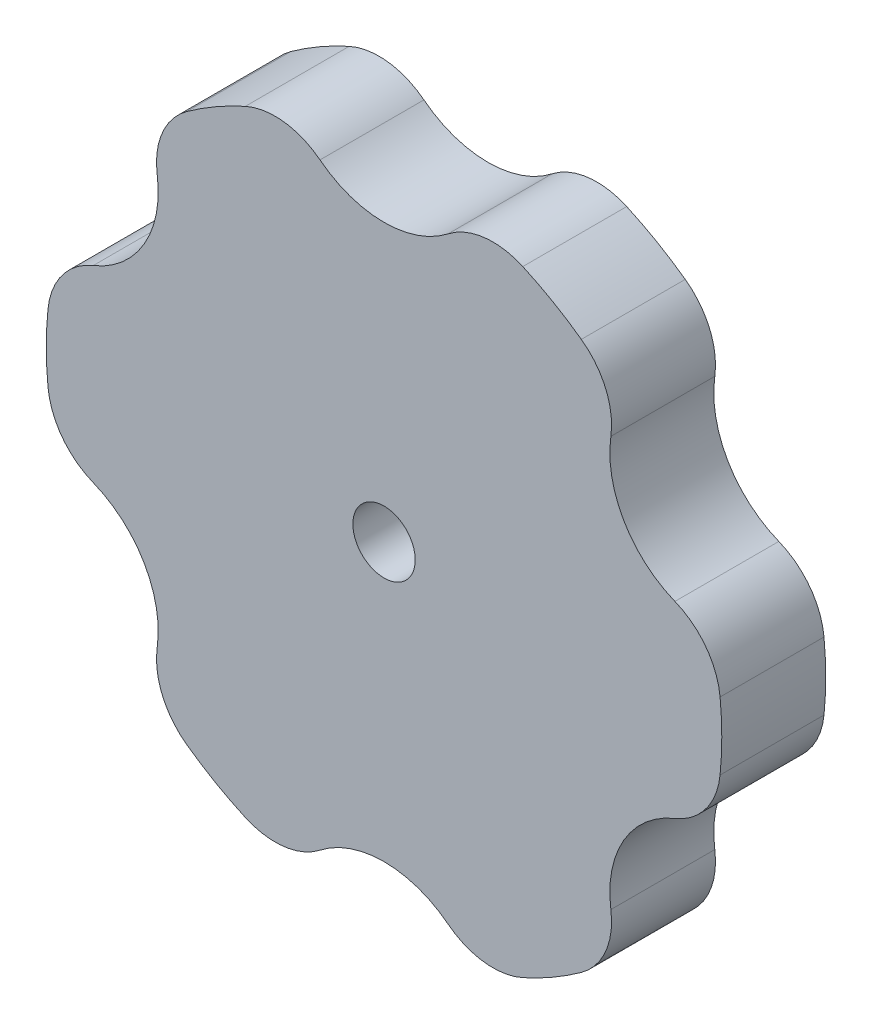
SolidWorks part; units mm, degrees
ref_plane "Plan de face" through (0, 0, 0) normal (0, 0, 1) x (1, 0, 0)
ref_plane "Plan de dessus" through (0, 0, 0) normal (0, 1, 0) x (1, 0, 0)
ref_plane "Plan de droite" through (0, 0, 0) normal (1, 0, 0) x (0, 0, -1)
sketch "Esquisse1" plane through (0, 0, 0) normal (0, 0, 1) x (1, 0, 0)
  arc A0 (-21.8266, -19.7177) -> (-18.9845, -26.3788) centre (-14.8955, -20.6972) ccw
  arc A1 (-18.9845, -26.3788) -> (-13.3525, -29.6304) centre (0, 0) ccw
  arc A2 (-13.3525, -29.6304) -> (-6.1627, -28.7612) centre (-10.4766, -23.2485) ccw
  arc A3 (6.1627, -28.7612) -> (-6.1627, -28.7612) centre (0, -36.6366) ccw
  arc A4 (6.1627, -28.7612) -> (13.3525, -29.6304) centre (10.4766, -23.2485) ccw
  arc A5 (13.3525, -29.6304) -> (18.9845, -26.3788) centre (0, 0) ccw
  arc A6 (18.9845, -26.3788) -> (21.8266, -19.7177) centre (14.8955, -20.6972) ccw
  arc A7 (27.9893, -9.0436) -> (21.8266, -19.7177) centre (31.7282, -18.3183) ccw
  arc A8 (27.9893, -9.0436) -> (32.3369, -3.2516) centre (25.3721, -2.5513) ccw
  arc A9 (32.3369, -3.2516) -> (32.3369, 3.2516) centre (0, 0) ccw
  arc A10 (32.3369, 3.2516) -> (27.9893, 9.0436) centre (25.3721, 2.5513) ccw
  arc A11 (21.8266, 19.7177) -> (27.9893, 9.0436) centre (31.7282, 18.3183) ccw
  arc A12 (21.8266, 19.7177) -> (18.9845, 26.3788) centre (14.8955, 20.6972) ccw
  arc A13 (18.9845, 26.3788) -> (13.3525, 29.6304) centre (0, 0) ccw
  arc A14 (13.3525, 29.6304) -> (6.1627, 28.7612) centre (10.4766, 23.2485) ccw
  arc A15 (-6.1627, 28.7612) -> (6.1627, 28.7612) centre (0, 36.6366) ccw
  arc A16 (-6.1627, 28.7612) -> (-13.3525, 29.6304) centre (-10.4766, 23.2485) ccw
  arc A17 (-13.3525, 29.6304) -> (-18.9845, 26.3788) centre (0, 0) ccw
  arc A18 (-18.9845, 26.3788) -> (-21.8266, 19.7177) centre (-14.8955, 20.6972) ccw
  arc A19 (-27.9893, 9.0436) -> (-21.8266, 19.7177) centre (-31.7282, 18.3183) ccw
  arc A20 (-27.9893, 9.0436) -> (-32.3369, 3.2516) centre (-25.3721, 2.5513) ccw
  arc A21 (-32.3369, 3.2516) -> (-32.3369, -3.2516) centre (0, 0) ccw
  arc A22 (-32.3369, -3.2516) -> (-27.9893, -9.0436) centre (-25.3721, -2.5513) ccw
  arc A23 (-21.8266, -19.7177) -> (-27.9893, -9.0436) centre (-31.7282, -18.3183) ccw
extrude "Boss.-Extru.1" add sketch "Esquisse1" along normal blind 10
sketch "Esquisse2" plane through (0, 0, 0) normal (0, 0, -1) x (-1, 0, 0)
  circle A0 centre (0, 0) radius 3
  dimension "D1" = 6
extrude "Enlèv. mat.-Extru.1" cut sketch "Esquisse2" against normal blind 10
